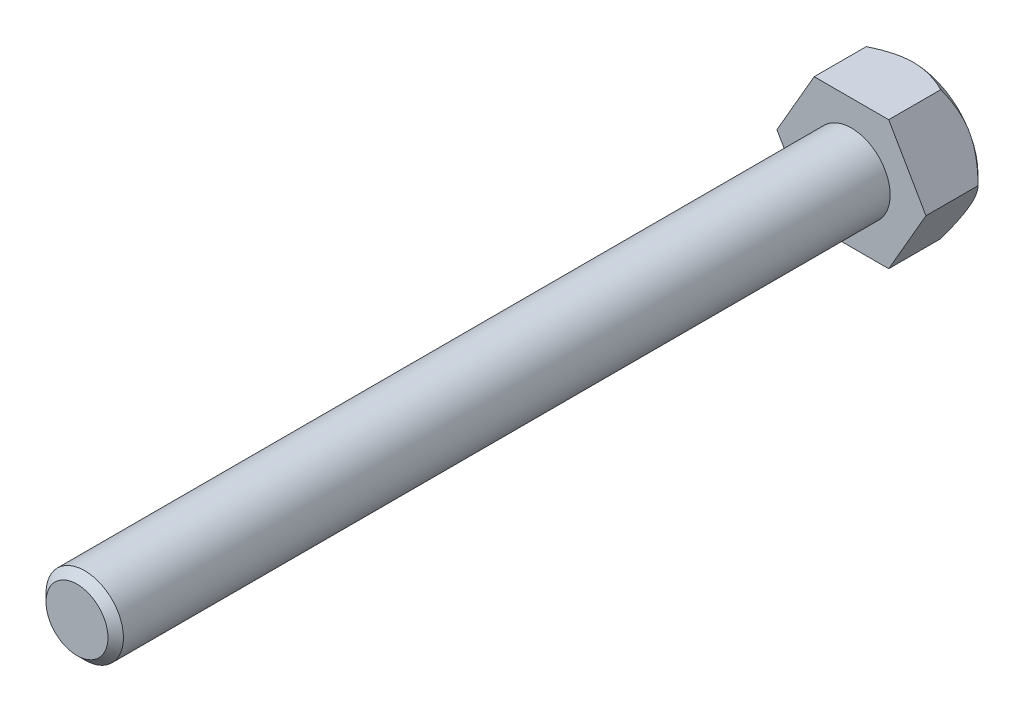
SolidWorks part; units mm, degrees
ref_plane "Plan de face" through (0, 0, 0) normal (0, 0, 1) x (1, 0, 0)
ref_plane "Plan de dessus" through (0, 0, 0) normal (0, 1, 0) x (1, 0, 0)
ref_plane "Plan de droite" through (0, 0, 0) normal (1, 0, 0) x (0, 0, -1)
sketch "Esquisse1" plane through (0, 0, 0) normal (0, 0, 1) x (1, 0, 0)
  line L1 (5.7735, 0) -> (2.8868, 5)
  line L2 (2.8868, 5) -> (-2.8868, 5)
  line L3 (-2.8868, 5) -> (-5.7735, 0)
  line L4 (-5.7735, 0) -> (-2.8868, -5)
  line L5 (-2.8868, -5) -> (2.8868, -5)
  line L6 (2.8868, -5) -> (5.7735, 0)
  circle A0 centre (0, 0) radius 5 construction
  dimension "D1" = 10
extrude "Extrusion1" add sketch "Esquisse1" along normal blind 4.8
sketch "Esquisse2" plane through (0, 0, 4.8) normal (0, 0, 1) x (1, 0, 0)
  circle A0 centre (0, 0) radius 3
  dimension "D1" = 6
extrude "Extrusion2" add sketch "Esquisse2" along normal blind 60
sketch "Esquisse3" plane through (0, 0, 0) normal (0, 1, 0) x (1, 0, 0)
  line L0 (5.7735, 0) -> (5.0043, 0)
  line L1 (5.7735, 0) -> (2.8868, 0) construction
  line L2 (5.0043, 0) -> (5.7735, -0.7692)
  line L3 (5.7735, -4.8) -> (5.7735, 0) construction
  line L4 (5.7735, -0.7692) -> (5.7735, 0)
  line L5 (0, 0) -> (0, -14.3949) construction
  dimension "D1" = 45
  dimension "D2" = 0.7692
revolve "Enlèvement de matière-Révolution1" cut sketch "Esquisse3" angle 360 about L5
chamfer "Chanfrein1" distance 0.6 angle 45 1 edges at (3, 0, 64.8)
equation "\"D1@Extrusion1\" = 0.8*\"D1@Esquisse2\""
equation "\"D2@Esquisse3\"=\"D1@Esquisse1\"/13"
equation "\"D1@Chanfrein1\"=\"D1@Esquisse2\"/10"
